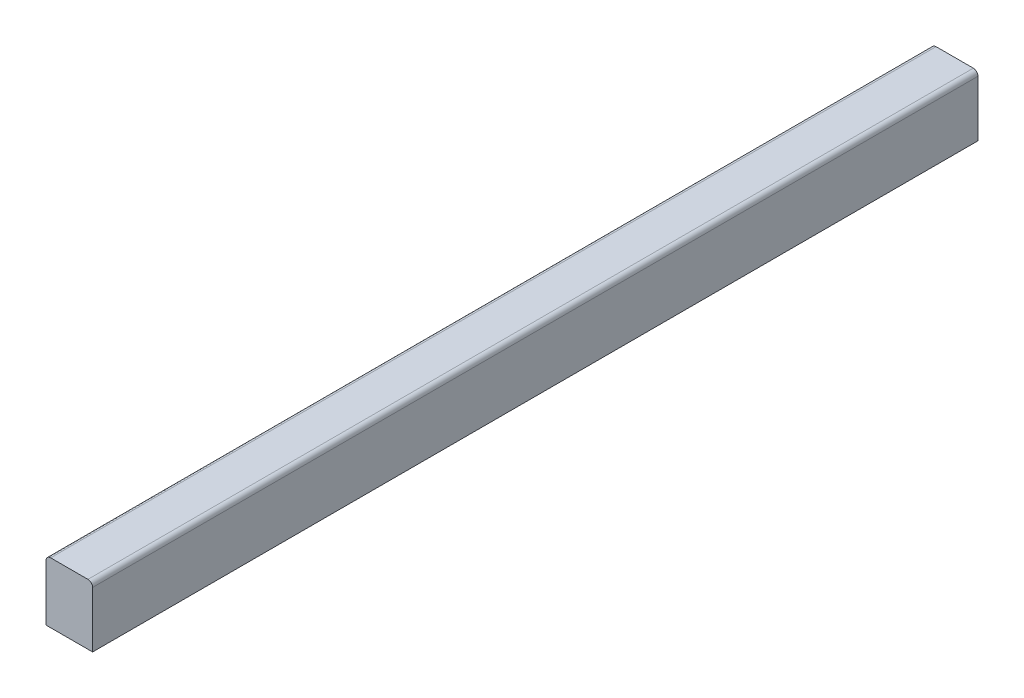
SolidWorks part; units mm, degrees
ref_plane "Piano frontale" through (0, 0, 0) normal (0, 0, 1) x (1, 0, 0)
ref_plane "Piano superiore" through (0, 0, 0) normal (0, 1, 0) x (1, 0, 0)
ref_plane "Piano destro" through (0, 0, 0) normal (1, 0, 0) x (0, 0, -1)
sketch "Schizzo1" plane through (0, 0, 0) normal (0, 0, 1) x (1, 0, 0)
  line L1 (-5, -6.5) -> (5, -6.5)
  line L2 (-5, -6.5) -> (-5, 6.5)
  line L3 (-5, 6.5) -> (5, 6.5)
  line L4 (5, -6.5) -> (5, 6.5)
  line L5 (-5, -6.5) -> (5, 6.5) construction
  line L6 (-5, 6.5) -> (5, -6.5) construction
  point P0 (0, 0)
  dimension "D1" = 10
  dimension "D2" = 13
extrude "Estrusione-Estrusione1" add sketch "Schizzo1" along normal blind 190
fillet "Raccordo1" radius 1 2 edges at (-5, 6.5, 95) (5, 6.5, 95)
